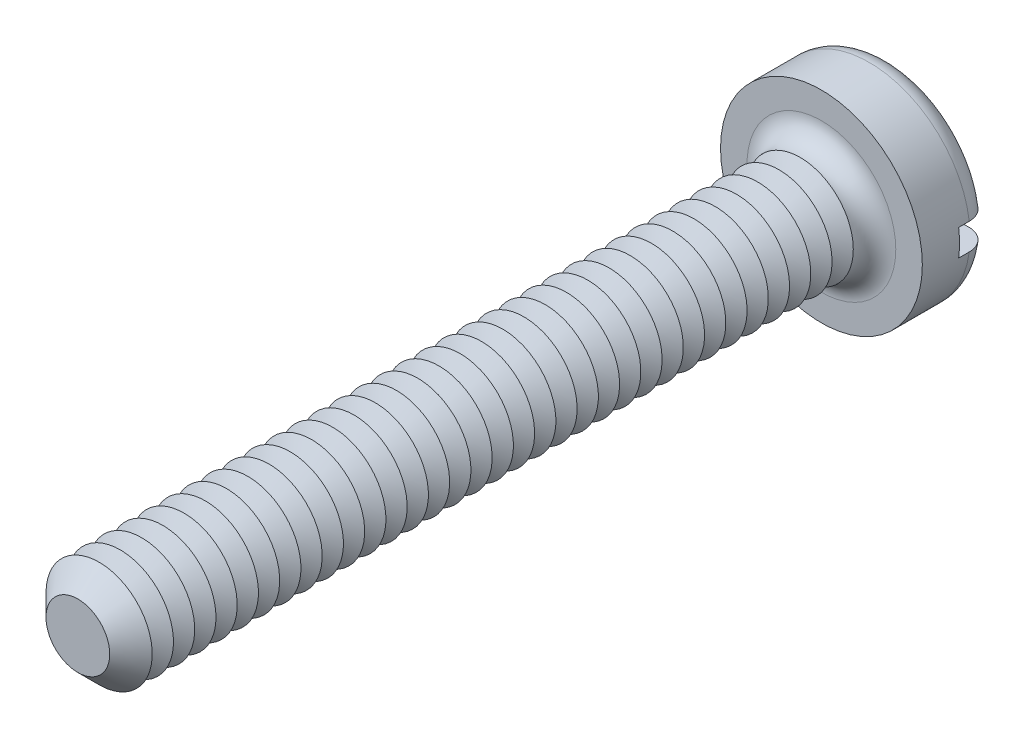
SolidWorks part; units mm, degrees
ref_plane "Front Plane" through (0, 0, 0) normal (0, 0, 1) x (1, 0, 0)
ref_plane "Top Plane" through (0, 0, 0) normal (0, 1, 0) x (1, 0, 0)
ref_plane "Right Plane" through (0, 0, 0) normal (1, 0, 0) x (0, 0, -1)
sketch "Sketch3" plane through (0, 0, 0) normal (0, 0, 1) x (1, 0, 0)
  circle A0 centre (0, 0) radius 1.9
  dimension "D1" = 3.8
extrude "Boss-Extrude2" add sketch "Sketch3" against normal blind 1.3
sketch "Sketch4" plane through (0, 0, 0) normal (0, 0, 1) x (1, 0, 0)
  circle A0 centre (0, 0) radius 1
  dimension "D1" = 2
extrude "Boss-Extrude3" add sketch "Sketch4" along normal blind 14
fillet "Fillet1" radius 0.4 2 edges at (1.9, 0, -1.3) (1, 0, 0)
chamfer "Chamfer1" distance 0.4 angle 45 1 edges at (1, 0, 14)
sketch "Sketch5" plane through (0, 0, 0) normal (1, 0, 0) x (0, 0, -1)
  line L0 (1.6944, 0) -> (-7.6738, 0) construction
sketch "Sketch6" plane through (0, 0, 0) normal (1, 0, 0) x (0, 0, -1)
  line L0 (-0.4, 1) -> (-0.6, 0.6536)
  line L1 (-0.6, 0.6536) -> (-0.8, 1)
  line L2 (-0.4, 1) -> (-13.6, 1) construction
  line L3 (-0.8, 1) -> (-0.4, 1)
  dimension "D1" = 0.4
revolve "Cut-Revolve1" cut sketch "Sketch6" angle 360 about L0
pattern_linear "LPattern1" count 33 spacing 0.4 along (0, 0, 1) of "Cut-Revolve1"
sketch "Sketch8" plane through (0, 0, -1.3) normal (0, 0, -1) x (-1, 0, 0)
  line L1 (1.9, -0.25) -> (-1.9, -0.25)
  line L2 (1.9, -0.25) -> (1.9, 0.25)
  line L3 (1.9, 0.25) -> (-1.9, 0.25)
  line L4 (-1.9, -0.25) -> (-1.9, 0.25)
  line L5 (1.9, -0.25) -> (-1.9, 0.25) construction
  line L6 (1.9, 0.25) -> (-1.9, -0.25) construction
  point P0 (0, 0)
  dimension "D1" = 3.8
  dimension "D2" = 0.5
extrude "Cut-Extrude1" cut sketch "Sketch8" against normal blind 0.6
